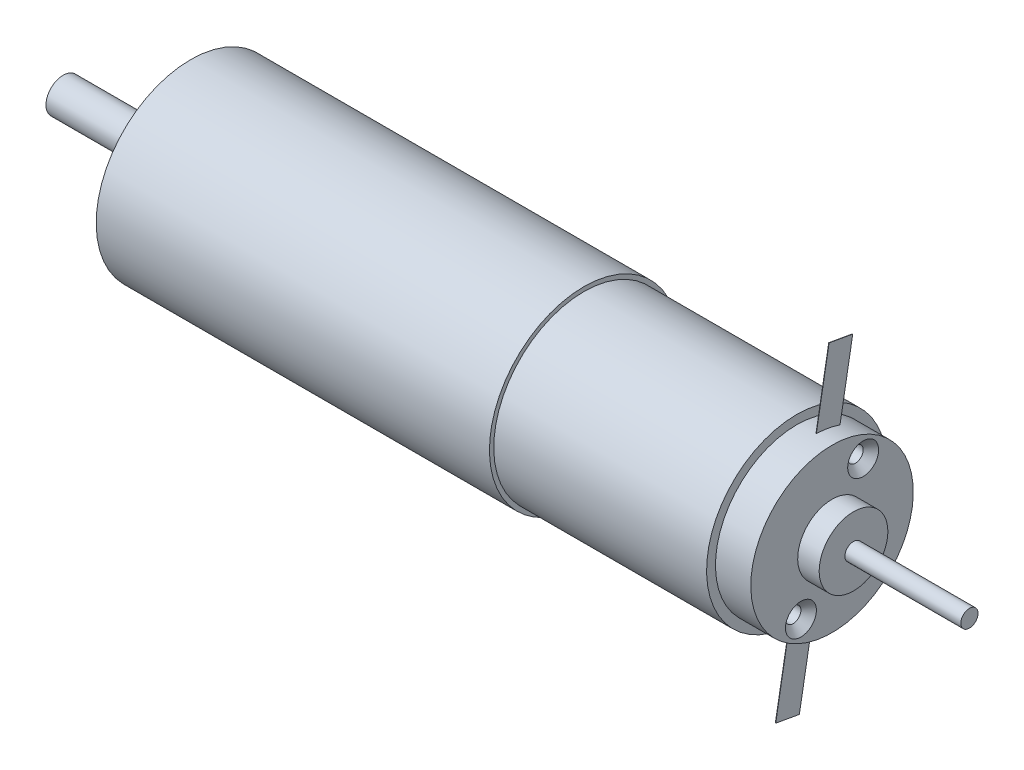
SolidWorks part; units mm, degrees
ref_plane "Front Plane" through (0, 0, 0) normal (0, 0, 1) x (1, 0, 0)
ref_plane "Top Plane" through (0, 0, 0) normal (0, 1, 0) x (1, 0, 0)
ref_plane "Right Plane" through (0, 0, 0) normal (1, 0, 0) x (0, 0, -1)
sketch "Sketch1" plane through (0, 0, 0) normal (0, 0, 1) x (1, 0, 0)
  line L0 (44.9, 0) -> (-60.65, 0) construction
  line L1 (0, -10.5) -> (24.7852, -10.5)
  line L2 (0, -10.5) -> (0, -11)
  line L3 (0, -11) -> (-45.8, -11)
  line L4 (24.7852, -10.5) -> (24.7852, -9.4615)
  line L5 (-45.8, -11) -> (-45.8, -5)
  line L6 (-45.8, -5) -> (-47.15, -5)
  line L7 (-47.15, -5) -> (-47.15, -3.4925)
  line L8 (-47.15, -3.4925) -> (-48.95, -3.4925)
  line L9 (-48.95, -3.4925) -> (-48.95, -2)
  line L10 (-48.95, -2) -> (-60.65, -2)
  line L11 (-60.65, -2) -> (-60.65, 0)
  line L12 (28.9, -4) -> (31.4, -4)
  line L13 (24.7852, -9.4615) -> (28.9, -9.4615)
  line L14 (28.9, -9.4615) -> (28.9, -4)
  line L15 (31.4, -4) -> (31.4, -1)
  line L16 (31.4, -1) -> (44.9, -1)
  line L17 (44.9, -1) -> (44.9, 0)
  line L18 (-60.65, 0) -> (44.9, 0)
  dimension "D1" = 22
  dimension "D2" = 28.9
  dimension "D3" = 21
  dimension "D4" = 45.8
  dimension "D5" = 10
  dimension "D6" = 1.35
  dimension "D7" = 6.985
  dimension "D8" = 3.15
  dimension "D9" = 4
  dimension "D10" = 14.85
  dimension "D11" = 18.923
  dimension "D12" = 4.1148
  dimension "D13" = 8
  dimension "D14" = 2.5
  dimension "D15" = 2
  dimension "D16" = 16
revolve "Revolve1" add sketch "Sketch1" angle 360 about L0
sketch "Sketch6" plane through (0, 0, 0) normal (0, 1, 0) x (1, 0, 0)
  line L0 (-60.65, 2) -> (-60.65, -2) construction
  line L1 (-63.9871, 5.1812) -> (-51.35, 5.1812)
  line L2 (-63.9871, 5.1812) -> (-63.9871, 1.5)
  line L3 (-63.9871, 1.5) -> (-51.35, 1.5)
  line L4 (-51.35, 5.1812) -> (-51.35, 1.5)
  line L5 (-60.65, -2) -> (-48.95, -2) construction
  dimension "D1" = 9.3
  dimension "D2" = 3.5
extrude "Cut-Extrude2" cut sketch "Sketch6" against normal through all and the other way through all
sketch "Sketch2" plane through (24.7852, 0, 0) normal (1, 0, 0) x (0, 0, -1)
  line L0 (0.9263, 5.2534) -> (0, 0) construction
  line L1 (1.7296, 17.8712) -> (-0.4524, 5.4965)
  line L2 (1.7296, 17.8712) -> (4.487, 17.385)
  line L3 (4.487, 17.385) -> (2.305, 5.0103)
  line L4 (-0.4524, 5.4965) -> (2.305, 5.0103)
  line L5 (0.9263, 5.2534) -> (3.1083, 17.6281) construction
  line L6 (0, 0) -> (0, 15.5687) construction
  line L7 (0, 0) -> (-7.582, 1.3369) construction
  line L8 (-4.487, -17.385) -> (-1.7296, -17.8712)
  line L9 (-4.487, -17.385) -> (-2.305, -5.0103)
  line L10 (-1.7296, -17.8712) -> (0.4524, -5.4965)
  line L11 (-2.305, -5.0103) -> (0.4524, -5.4965)
  dimension "D1" = 2.8
  dimension "D2" = 17.9
  dimension "D3" = 10
extrude "Extrude1" add sketch "Sketch2" along normal blind 0.04 from offset 2
hole_wizard "M2.5x0.45 Tapped Hole1" positions "Sketch5" profile "Sketch4" tap size "M2.5x0.45" standard "Ansi Metric"
sketch "Sketch5" plane through (-45.8, 0, 0) normal (-1, 0, 0) x (0, 0, 1)
  line L0 (0, 0) -> (0, 7) construction
  line L1 (0, 0) -> (6.0622, -3.5) construction
  line L2 (0, 0) -> (-6.0622, -3.5) construction
  circle A0 centre (0, 0) radius 7 construction
  point P0 (0, 7)
  point P1 (6.0622, -3.5)
  point P3 (-6.0622, -3.5)
  dimension "D3" = 14
  dimension "D1" = 120
  dimension "D2" = 120
sketch "Sketch4" plane through (-45.8, 7, 0) normal (0, 1, 0) x (0, 0, 1)
  line L0 (0, 0) -> (0, 5.9659)
  line L1 (0, 5.9659) -> (1.025, 5.35)
  line L2 (1.025, 5.35) -> (1.025, 0)
  line L5 (1.025, 0) -> (0, 0)
  line L10 (0, 5.9659) -> (-1.025, 5.35) construction
  line L11 (0, -6.35) -> (0, 107.95) construction
  dimension "Tap Drill Dia." = 2.05
  dimension "Tap Drill Depth" = 5.35
  dimension "Drill Angle" = 118
hole_wizard "CSK for M1.6 Countersunk Flat Head1" positions "Sketch8" profile "Sketch7" countersink size "M1.6" standard "BSI"
sketch "Sketch8" plane through (28.9, 0, 0) normal (1, 0, 0) x (0, 0, -1)
  line L0 (0, 0) -> (0, 12.9146) construction
  line L1 (0, 0) -> (3.625, 6.2787) construction
  line L2 (0, 0) -> (-3.625, -6.2787) construction
  circle A0 centre (0, 0) radius 7.25 construction
  point P0 (3.625, 6.2787)
  point P11 (-3.625, -6.2787)
  dimension "D1" = 30
  dimension "D2" = 14.5
sketch "Sketch7" plane through (28.9, 6.2787, -3.625) normal (0, 1, 0) x (0, 0, -1)
  line L0 (0, 0) -> (0, 4.8908)
  line L1 (0, 4.8908) -> (0.9, 4.35)
  line L2 (0.9, 4.35) -> (0.9, 0.9)
  line L3 (0.9, 0.9) -> (1.8, 0)
  line L5 (1.8, 0) -> (0, 0)
  line L6 (-0.9, 0.9) -> (-1.8, 0) construction
  line L10 (0, 4.8908) -> (-0.9, 4.35) construction
  line L11 (0, -6.35) -> (0, 107.95) construction
  dimension "Hole Dia." = 1.8
  dimension "Hole Depth" = 4.35
  dimension "Near C'Sink Dia." = 3.6
  dimension "Near C'Sink Angle" = 90
  dimension "Drill Angle" = 118
ref_plane "Plane1" through (0, 0, 0) normal (0, 0, 1) x (1, 0, 0)
